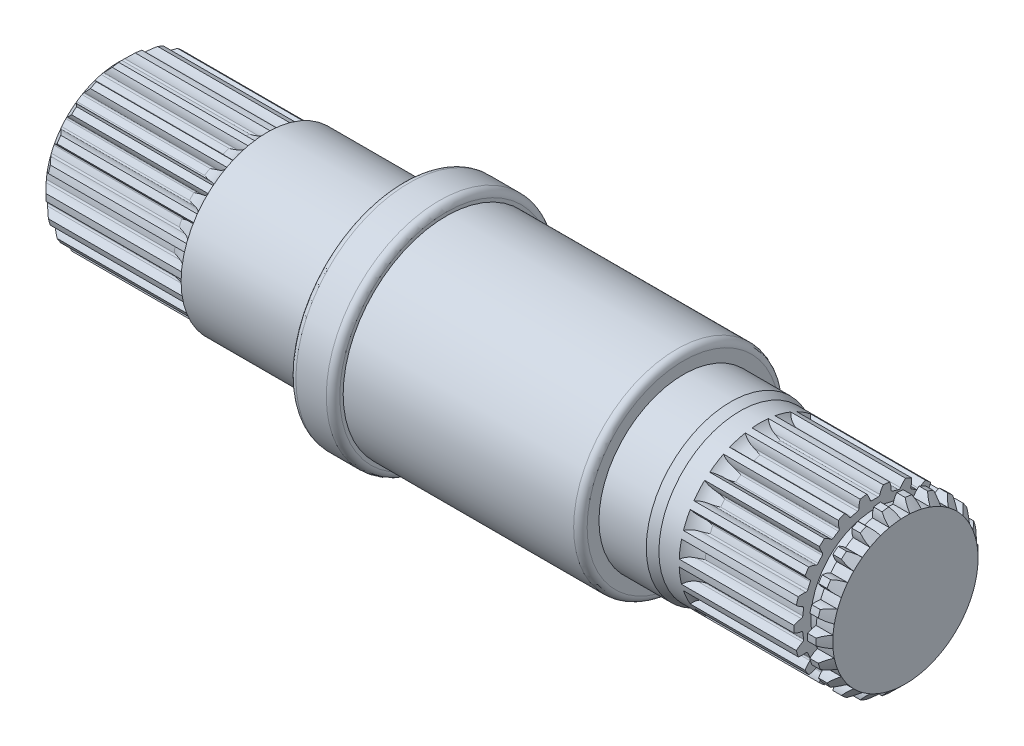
SolidWorks part; units mm, degrees
ref_plane "Front Plane" through (0, 0, 0) normal (0, 0, 1) x (1, 0, 0)
ref_plane "Top Plane" through (0, 0, 0) normal (0, 1, 0) x (1, 0, 0)
ref_plane "Right Plane" through (0, 0, 0) normal (1, 0, 0) x (0, 0, -1)
sketch "Sketch1" plane through (0, 0, 0) normal (0, 0, 1) x (1, 0, 0)
  line L0 (116.5, 0) -> (0, 0) construction
  line L1 (0, 0) -> (0, 12) construction
  line L2 (0, 12) -> (22, 12)
  line L3 (22, 12) -> (22, 12.75)
  line L4 (22, 12.75) -> (42, 12.75)
  line L5 (42, 12.75) -> (42, 16.75)
  line L6 (42, 16.75) -> (48.5, 16.75)
  line L7 (48.5, 16.75) -> (48.5, 15.25)
  line L8 (48.5, 15.25) -> (83.6263, 15.25)
  line L9 (83.6263, 15.25) -> (83.6263, 12.5)
  line L10 (83.6263, 12.5) -> (90.6263, 12.5)
  line L11 (90.6263, 12.5) -> (92, 12)
  line L12 (92, 12) -> (112, 12)
  line L13 (112, 12) -> (112, 9.5)
  line L14 (112, 9.5) -> (114, 9.5)
  line L15 (114, 9.5) -> (114, 12)
  line L16 (114, 12) -> (116.5, 12)
  line L17 (116.5, 12) -> (116.5, 0)
  line L18 (0, 12) -> (0, 0)
  line L19 (0, 0) -> (116.5, 0)
  dimension "D1" = 116.5
  dimension "D2" = 12
  dimension "D3" = 2.5
  dimension "D4" = 2
  dimension "D5" = 20
  dimension "D6" = 160
  dimension "D7" = 7
  dimension "D8" = 2.75
  dimension "D9" = 16.75
  dimension "D10" = 15.25
  dimension "D11" = 20
  dimension "D12" = 22
  dimension "D13" = 6.5
  dimension "D14" = 2.5
  dimension "D15" = 4
revolve "Revolve1" add sketch "Sketch1" angle 360 about L19
sketch "Sketch2" plane through (0, 0, 0) normal (-1, 0, 0) x (0, 0, 1)
  line L0 (0, 12) -> (0, 0) construction
  circle A0 centre (0, 0) radius 10.75 construction
  circle A1 centre (0, 0) radius 12
  circle A2 centre (0, 0) radius 12 construction
  circle A3 centre (3.8, 10.056) radius 3.2 construction
  circle A4 centre (-3.8, 10.056) radius 3.2 construction
  arc A5 (-0.6716, 10.729) -> (0.6716, 10.729) centre (0, 0) cw
  arc A6 (-1.2124, 11.9386) -> (1.2124, 11.9386) centre (0, 0) cw
  arc A7 (-1.2124, 11.9386) -> (-0.6716, 10.729) centre (-3.8, 10.056) cw
  arc A8 (1.2124, 11.9386) -> (0.6716, 10.729) centre (3.8, 10.056) ccw
  dimension "D2" = 21.5
  dimension "D3" = 6.4
  dimension "D4" = 3.8
  dimension "D1" = 0
extrude "Cut-Extrude1" cut sketch "Sketch2" against normal blind 21.5
fillet "Fillet1" radius 0.25 2 edges at (10.75, 10.729, 0.6716) (10.75, 10.729, -0.6716)
fillet "Fillet3" radius 3.25 1 edges at (21.5, 10.75, 0)
pattern_circular "CirPattern1" count 22 over 360 about axis through (0, 0, 0) along (1, 0, 0) of "Fillet3", "Cut-Extrude1", "Fillet1"
sketch "Sketch3" plane through (0, 0, 0) normal (-1, 0, 0) x (0, 0, 1)
  circle A0 centre (0, 0) radius 10.75
extrude "Cut-Extrude2" cut sketch "Sketch3" against normal blind 21.5 draft 45 flip side to cut
ref_plane "Plane1" through (58.25, 0, 0) normal (1, 0, 0) x (0, 0, -1)
mirror "Mirror2" about plane through (58.25, 0, 0) normal (1, 0, 0) of "Cut-Extrude1", "Fillet1", "Fillet3"
pattern_circular "CirPattern3" count 22 over 360 about axis through (0, 0, 0) along (1, 0, 0) of "Mirror2", "Cut-Extrude1", "Fillet1", "Fillet3"
sketch "Sketch7" plane through (116.5, 0, 0) normal (1, 0, 0) x (0, 0, -1)
  circle A0 centre (0, 0) radius 10.75
extrude "Cut-Extrude3" cut sketch "Sketch7" against normal blind 21.5 draft 45 flip side to cut
fillet "Fillet4" radius 1 3 edges at (48.5, 0, 16.75) (42, 0, 16.75) (83.6263, 0, 15.25)
